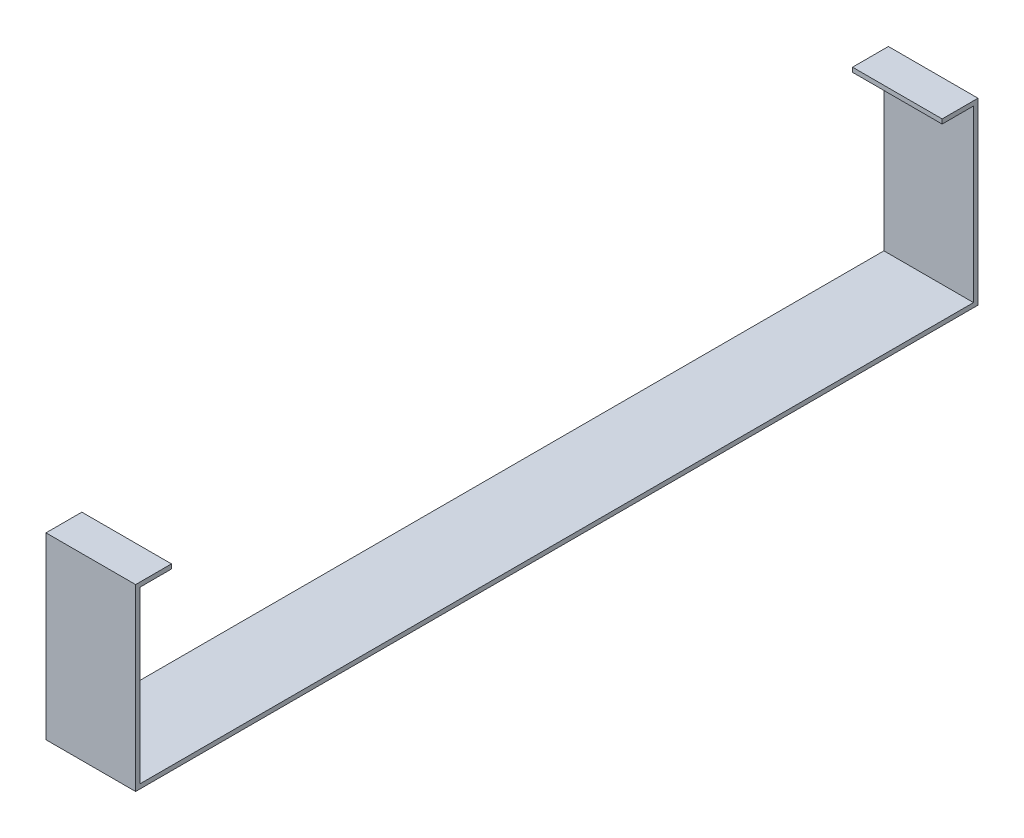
SolidWorks part; units mm, degrees
ref_plane "Piano frontale" through (0, 0, 0) normal (0, 0, 1) x (1, 0, 0)
ref_plane "Piano superiore" through (0, 0, 0) normal (0, 1, 0) x (1, 0, 0)
ref_plane "Piano destro" through (0, 0, 0) normal (1, 0, 0) x (0, 0, -1)
sketch "Sketch1" plane through (0, 0, 0) normal (1, 0, 0) x (0, 0, -1)
  line L0 (0, 0) -> (0, 180)
  line L1 (0, 180) -> (36, 180)
  line L2 (36, 180) -> (36, 175.5)
  line L3 (36, 175.5) -> (4.5, 175.5)
  line L4 (4.5, 175.5) -> (4.5, 4.5)
  line L5 (4.5, 4.5) -> (841.5, 4.5)
  line L6 (841.5, 4.5) -> (841.5, 175.5)
  line L7 (841.5, 175.5) -> (810, 175.5)
  line L8 (810, 175.5) -> (810, 180)
  line L9 (810, 180) -> (846, 180)
  line L10 (846, 180) -> (846, 0)
  line L11 (846, 0) -> (0, 0)
extrude "Boss-Extrude1" add sketch "Sketch1" against normal blind 90
